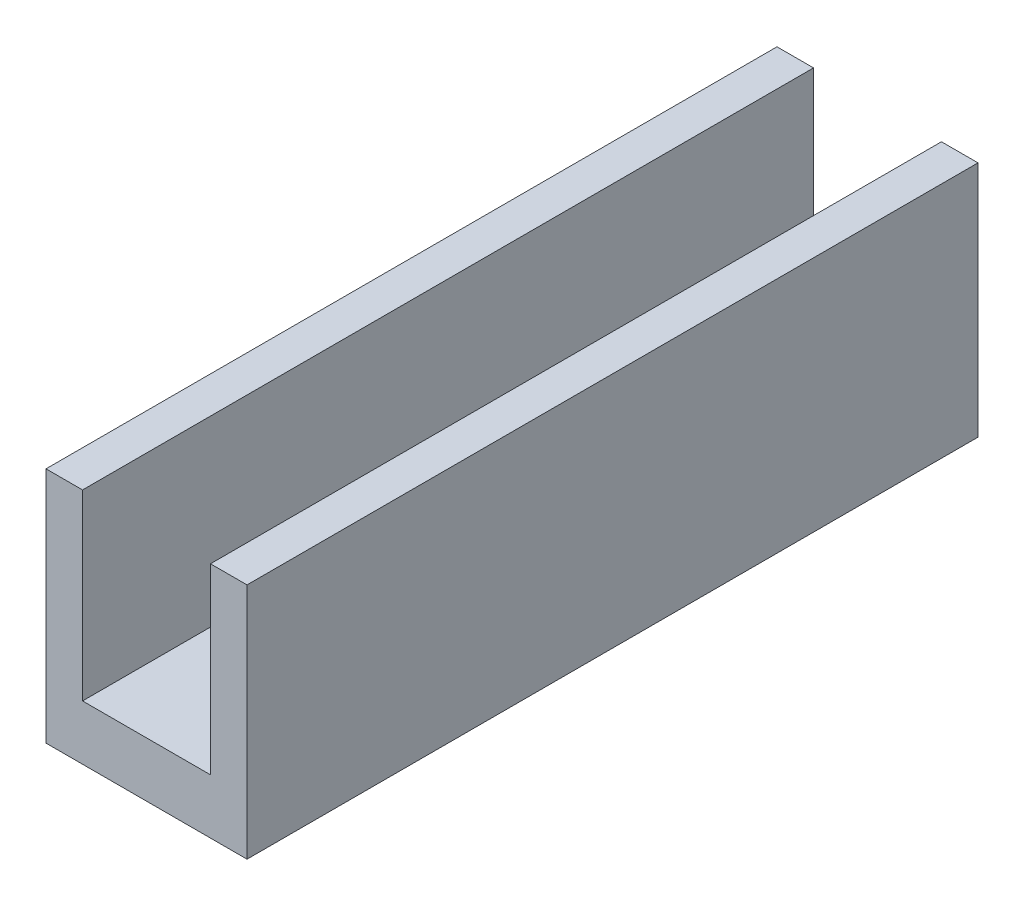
SolidWorks part; units mm, degrees
ref_plane "Front Plane" through (0, 0, 0) normal (0, 0, 1) x (1, 0, 0)
ref_plane "Top Plane" through (0, 0, 0) normal (0, 1, 0) x (1, 0, 0)
ref_plane "Right Plane" through (0, 0, 0) normal (1, 0, 0) x (0, 0, -1)
sketch "Sketch1" plane through (0, 0, 0) normal (0, 0, 1) x (1, 0, 0)
  line L0 (7, 20) -> (7, 0)
  line L1 (7, 0) -> (-7, 0)
  line L3 (-11, -6) -> (11, -6)
  line L4 (11, -6) -> (11, 20)
  line L5 (11, 20) -> (7, 20)
  line L6 (0, 0) -> (0, 23.7469) construction
  line L7 (-11, 20) -> (-7, 20)
  line L8 (-11, -6) -> (-11, 20)
  line L9 (-7, 20) -> (-7, 0)
  dimension "D1" = 7
  dimension "D2" = 20
  dimension "D3" = 4
  dimension "D4" = 6
extrude "Boss-Extrude1" add sketch "Sketch1" along normal blind 80
